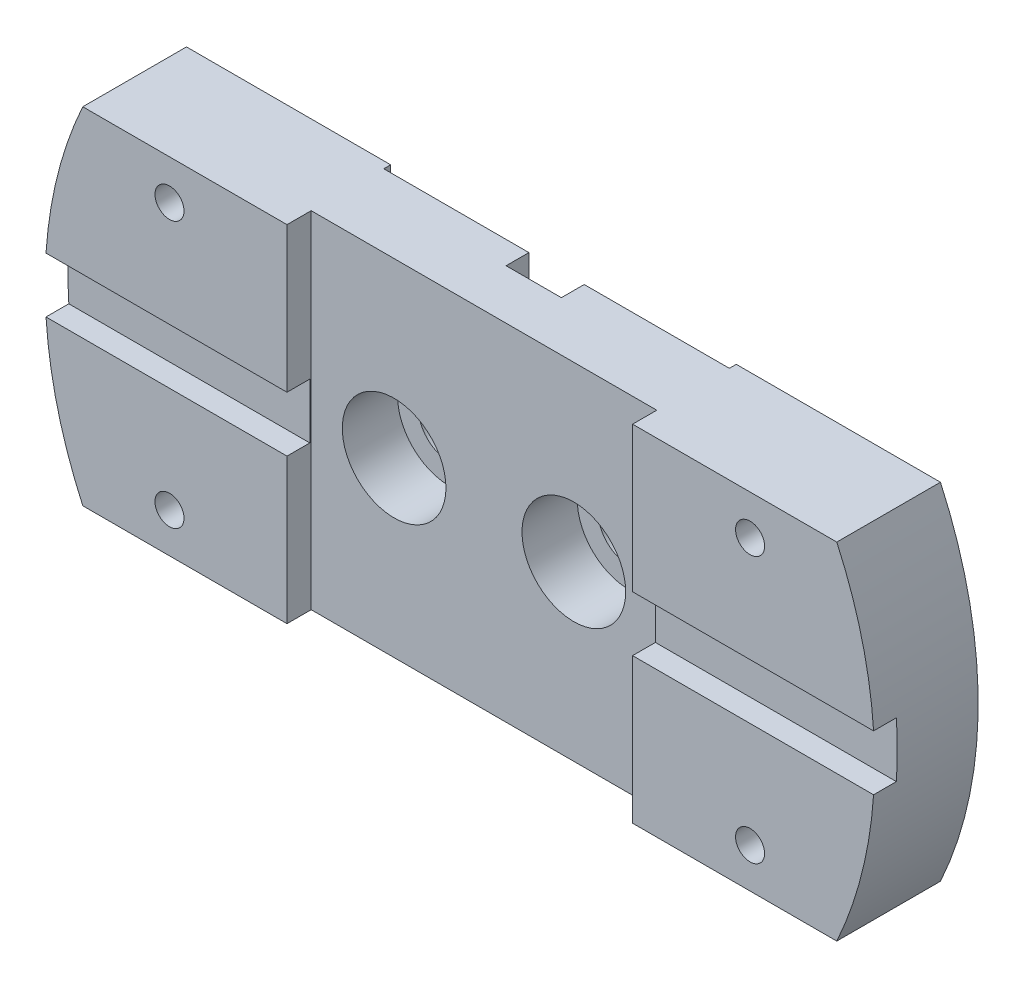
SolidWorks part; units mm, degrees
ref_plane "Face" through (0, 0, 0) normal (0, 0, 1) x (1, 0, 0)
ref_plane "Dessus" through (0, 0, 0) normal (0, 1, 0) x (1, 0, 0)
ref_plane "Droite" through (0, 0, 0) normal (1, 0, 0) x (0, 0, -1)
sketch "Esquisse1" plane through (0, 0, 0) normal (0, 0, 1) x (1, 0, 0)
  line L1 (-54.5436, 25) -> (54.5436, 25)
  line L3 (-54.5436, -25) -> (54.5436, -25)
  arc A0 (-54.5436, 25) -> (-54.5436, -25) centre (0, 0) ccw
  arc A1 (54.5436, -25) -> (54.5436, 25) centre (0, 0) ccw
  dimension "D1" = 120
  dimension "D2" = 25
  dimension "D3" = 25
extrude "Extrusion1" add sketch "Esquisse1" along normal blind 15
sketch "Esquisse2" plane through (0, 0, 0) normal (0, 1, 0) x (1, 0, 0)
  line L0 (54.5436, 0) -> (-54.5436, 0) construction
  line L1 (-25, 9) -> (25, 9)
  line L2 (-25, 9) -> (-25, -1)
  line L3 (-25, -1) -> (25, -1)
  line L4 (25, 9) -> (25, -1)
  dimension "D1" = 1
  dimension "D2" = 10
  dimension "D3" = 25
  dimension "D4" = 25
extrude "Enlèv. mat.-Extru.1" cut sketch "Esquisse2" against normal through all and the other way through all
sketch "Esquisse3" plane through (0, 0, 1) normal (0, 0, -1) x (-1, 0, 0)
  line L1 (-4, 30) -> (4, 30)
  line L2 (-4, 30) -> (-4, -30)
  line L3 (-4, -30) -> (4, -30)
  line L4 (4, 30) -> (4, -30)
  dimension "D1" = 4
  dimension "D2" = 4
  dimension "D3" = 30
  dimension "D4" = 30
extrude "Enlèv. mat.-Extru.2" cut sketch "Esquisse3" against normal blind 3.3
sketch "Esquisse4" plane through (0, 0, 15) normal (0, 0, 1) x (1, 0, 0)
  line L1 (-25, 30) -> (25, 30)
  line L2 (-25, 30) -> (-25, -30)
  line L3 (-25, -30) -> (25, -30)
  line L4 (25, 30) -> (25, -30)
  dimension "D1" = 30
  dimension "D2" = 30
  dimension "D3" = 25
  dimension "D4" = 25
extrude "Enlèv. mat.-Extru.3" cut sketch "Esquisse4" against normal blind 3.5
sketch "Esquisse5" plane through (0, 0, 0) normal (1, 0, 0) x (0, 0, -1)
  line L0 (-15, 25) -> (-15, -25) construction
  line L1 (-21.7, 4) -> (-11.7, 4)
  line L2 (-21.7, 4) -> (-21.7, -4)
  line L3 (-21.7, -4) -> (-11.7, -4)
  line L4 (-11.7, 4) -> (-11.7, -4)
  dimension "D1" = 4
  dimension "D2" = 4
  dimension "D3" = 3.3
  dimension "D4" = 10
extrude "Enlèv. mat.-Extru.4" cut sketch "Esquisse5" against normal through all and the other way through all
hole_wizard "Chambrage pour vis à tête cylindrique à 6 pans creux (ou vis CHC) M81" positions "Esquisse7" profile "Esquisse6" counterbore size "M8" standard "Ansi Métrique"
sketch "Esquisse7" plane through (0, 0, 11.5) normal (0, 0, 1) x (1, 0, 0)
  point P0 (13, 0)
  point P1 (-13, 0)
  dimension "D1" = 13
  dimension "D2" = 13
sketch "Esquisse6" plane through (13, 0, 11.5) normal (1, 0, 0) x (0, -1, 0)
  line L0 (0, 0) -> (0, 22.7039)
  line L1 (0, 22.7039) -> (4.5, 20)
  line L2 (4.5, 20) -> (4.5, 8)
  line L3 (4.5, 8) -> (7.5, 8)
  line L4 (7.5, 8) -> (7.5, 0)
  line L5 (7.5, 0) -> (0, 0)
  line L10 (0, 22.7039) -> (-4.5, 20) construction
  line L11 (0, -6.35) -> (0, 107.95) construction
  dimension "Diamètre du perçage" = 9
  dimension "Profondeur du perçage" = 20
  dimension "Diamètre du chambrage" = 15
  dimension "Profondeur du chambrage" = 8
  dimension "Angle de pointe" = 118
hole_wizard "Trou taraudé M5x0.81" positions "Esquisse9" profile "Esquisse8" tap size "M5x0.8" standard "Ansi Métrique"
sketch "Esquisse9" plane through (0, 0, 15) normal (0, 0, 1) x (1, 0, 0)
  point P1 (-42, -19.25)
  point P2 (42, -19.25)
  point P4 (-42, 19.25)
  point P6 (42, 19.25)
sketch "Esquisse8" plane through (-42, -19.25, 15) normal (1, 0, 0) x (0, -1, 0)
  line L0 (0, 0) -> (0, 15)
  line L1 (0, 15) -> (2.1, 15)
  line L2 (2.1, 15) -> (2.1, 0)
  line L5 (2.1, 0) -> (0, 0)
  line L11 (0, -6.35) -> (0, 107.95) construction
  dimension "Diamètre du trou pour taraudage jusqu'au prochain" = 4.2
  dimension "Profondeur du trou pour taraudage jusqu'au prochain" = 15
